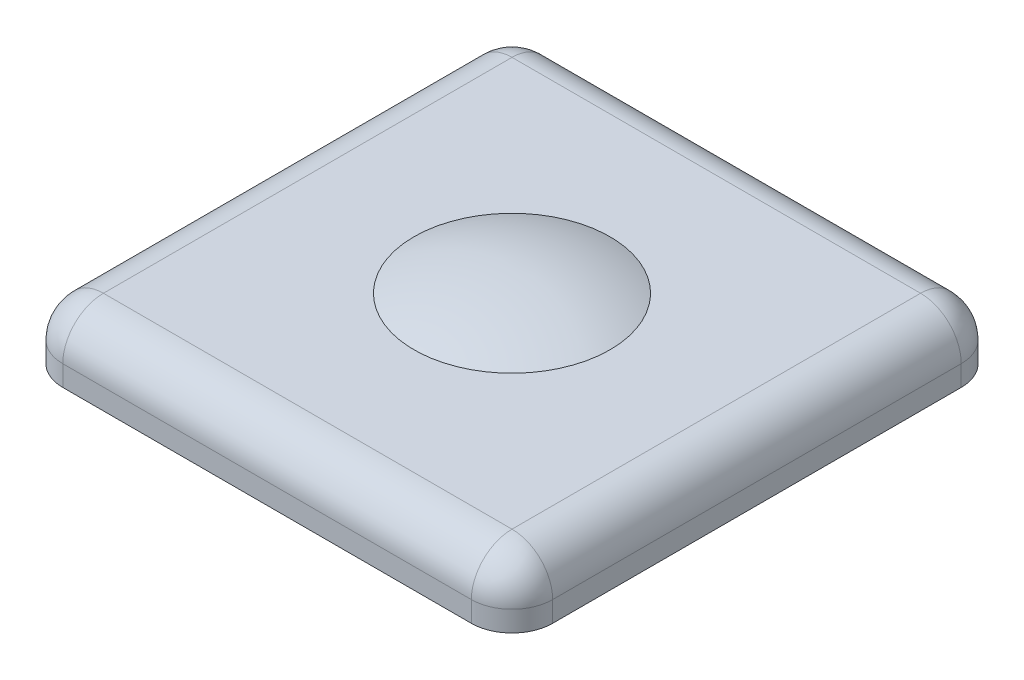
SolidWorks part; units mm, degrees
ref_plane "Front Plane" through (0, 0, 0) normal (0, 0, 1) x (1, 0, 0)
ref_plane "Top Plane" through (0, 0, 0) normal (0, 1, 0) x (1, 0, 0)
ref_plane "Right Plane" through (0, 0, 0) normal (1, 0, 0) x (0, 0, -1)
sketch "Sketch1" plane through (0, 0, 0) normal (0, 1, 0) x (1, 0, 0)
  line L0 (-12.7, 0) -> (12.7, 0) construction
  line L1 (0, -3.2639) -> (0, 3.2639) construction
  line L2 (-3.175, 12.7) -> (3.175, 12.7) construction
  line L3 (0, 12.7) -> (0, 10.5918) construction
  point P4 (0, 0)
  point P8 (0, 0)
  point P11 (0, 12.7)
sketch "Sketch2" plane through (0, 0, 0) normal (0, 0, 1) x (1, 0, 0)
  line L0 (0, -7.0485) -> (0, 7.0485) construction
  line L2 (5.08, 5.9954) -> (-5.08, 5.9954) construction
  line L3 (3.048, -7.0485) -> (-3.048, -7.0485) construction
  line L4 (1.6002, 0) -> (-1.6002, 0) construction
  line L5 (-3.175, 0) -> (3.175, 0) construction
  point P0 (0, 2.8204)
  point P3 (0, 0)
  point P9 (0, 5.9954)
  point P10 (0, -7.0485)
  point P11 (0, -7.0485)
  point P17 (0, 0)
  dimension "OAL" = 14.097
  dimension "Head Height" = 1.0531
  dimension "Cap Thickness" = 3.175
  dimension "Rivet Head Dea" = 10.16
  dimension "Rivet Dia" = 3.2004
  dimension "Rivet Flange Dia" = 6.096
sketch "Sketch3" plane through (0, 0, 0) normal (0, 1, 0) x (1, 0, 0)
  line L1 (12.7, -12.7) -> (-12.7, -12.7)
  line L2 (12.7, -12.7) -> (12.7, 12.7)
  line L3 (12.7, 12.7) -> (-12.7, 12.7)
  line L4 (-12.7, -12.7) -> (-12.7, 12.7)
  line L5 (12.7, -12.7) -> (-12.7, 12.7) construction
  line L6 (12.7, 12.7) -> (-12.7, -12.7) construction
  circle A0 centre (0, 0) radius 3.2639
  point P0 (0, 0)
extrude "Boss-Extrude1" add sketch "Sketch3" against normal up to vertex (-2.8204 mm away) from vertex at 5.9954
sketch "Sketch4" plane through (0, 2.8204, 0) normal (0, -1, 0) x (1, 0, 0)
  line L1 (-3.175, -12.7) -> (3.175, -12.7)
  line L2 (-3.175, -12.7) -> (-3.175, -10.5918)
  line L3 (-3.175, -10.5918) -> (3.175, -10.5918)
  line L4 (3.175, -12.7) -> (3.175, -10.5918)
extrude "Boss-Extrude2" add sketch "Sketch4" along normal blind 2.1082
fillet "Fillet1" radius 2.1082 8 edges at (-12.7, 5.9954, 0) (0, 5.9954, -12.7) (12.7, 5.9954, 0) (0, 5.9954, 12.7) (12.7, 4.4079, 12.7) (12.7, 4.4079, -12.7) (-12.7, 4.4079, -12.7) (-12.7, 4.4079, 12.7)
sketch "Sketch5" plane through (0, 0, 0) normal (0, 0, 1) x (1, 0, 0)
  line L0 (0, -7.0485) -> (0, 7.0485) construction
  line L1 (0, -7.0485) -> (0, 7.0485) construction
  line L2 (-5.08, 5.9954) -> (-1.6002, 5.9954)
  line L3 (5.08, 5.9954) -> (-5.08, 5.9954) construction
  line L4 (-1.6002, 5.9954) -> (-1.6002, 2.3966)
  line L5 (-1.6002, 2.3966) -> (-3.048, 2.9535)
  line L6 (-3.048, 2.9535) -> (-1.6002, 1.422)
  line L7 (-1.6002, 1.422) -> (-1.6002, 2.3966) construction
  line L8 (-1.6002, 1.422) -> (-1.6002, 0.914)
  line L9 (-1.6002, 0.914) -> (-3.048, 1.4709)
  line L10 (-3.048, 1.4709) -> (-1.6002, -0.0606)
  line L11 (-1.6002, -0.0606) -> (-1.6002, -0.5686)
  line L12 (-1.6002, -0.5686) -> (-3.048, -0.0117)
  line L13 (-3.048, -0.0117) -> (-1.6002, -1.5433)
  line L14 (-1.6002, -1.5433) -> (-1.6002, -2.0513)
  line L15 (-1.6002, -2.0513) -> (-3.048, -1.4943)
  line L16 (-3.048, -1.4943) -> (-1.6002, -3.0259)
  line L17 (-1.6002, -3.0259) -> (-1.6002, -3.5339)
  line L18 (-1.6002, -3.5339) -> (-3.048, -2.977)
  line L19 (-3.048, -2.977) -> (-1.6002, -4.5085)
  line L20 (-1.6002, -4.5085) -> (-1.6002, -5.0165) construction
  line L21 (-1.6002, -4.5085) -> (-3.048, -4.5085)
  line L22 (-3.048, -4.5085) -> (-1.6589, -6.0579)
  line L23 (-1.6589, -6.0579) -> (-1.6589, -6.3881)
  line L24 (-1.6589, -6.3881) -> (-1.7859, -6.3881)
  line L25 (-1.7859, -6.3881) -> (-1.1938, -7.0485)
  line L26 (3.048, -7.0485) -> (-3.048, -7.0485) construction
  line L27 (-1.1938, -7.0485) -> (0, -7.0485)
  line L28 (0, -7.0485) -> (0, 7.0485)
  arc A0 (-5.08, 5.9954) -> (0, 7.0485) centre (0, -5.7308) cw
revolve "Revolve1" add sketch "Sketch5" angle 360 about L0
sketch "Sketch6" plane through (0, 5.9954, 0) normal (0, -1, 0) x (1, 0, 0)
  line L0 (0, 0) -> (0, 5.08) construction
  line L1 (1.6463, 5.08) -> (-1.6463, 5.08)
  line L2 (-1.6463, 5.08) -> (-0.635, 1.4688)
  line L3 (1.6463, 5.08) -> (0.635, 1.4688)
  circle A0 centre (0, 0) radius 5.08 construction
  circle A1 centre (0, 0) radius 1.6002 construction
  arc A2 (0.635, 1.4688) -> (-0.635, 1.4688) centre (0, 0) ccw
  dimension "D1" = 1.27
  dimension "D2" = 31.29
extrude "Cut-Extrude1" cut sketch "Sketch6" along normal up to surface (12.3835 mm away)
equation "\"D3@Sketch1\"=\"Cap Width@Sketch1\""
equation "\"D1@Boss-Extrude2\"=\"D2@Sketch1\""
equation "\"D1@Fillet1\"=\"D2@Sketch1\""
equation "\"D10@Sketch5\"=\"D6@Sketch5\"/2"
